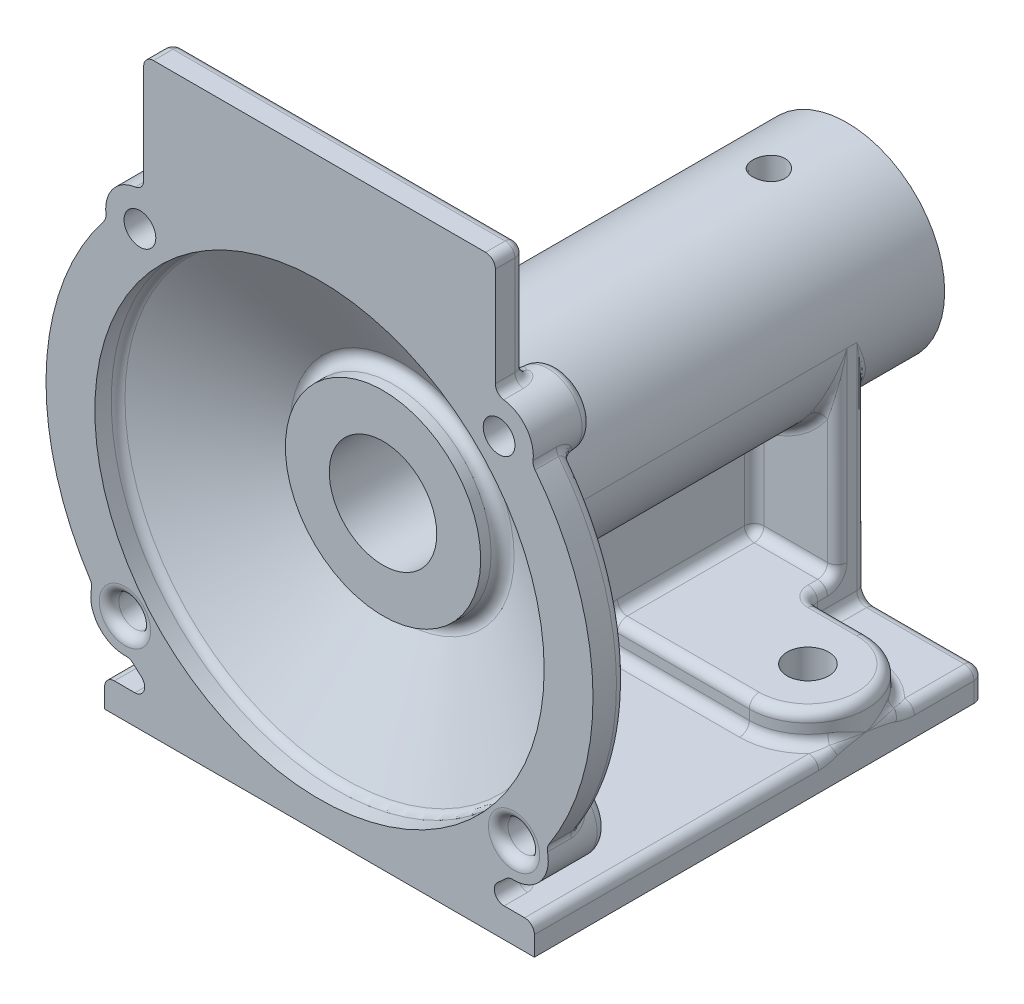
SolidWorks part; units mm, degrees
ref_plane "Front Plane" through (0, 0, 0) normal (0, 0, 1) x (1, 0, 0)
ref_plane "Top Plane" through (0, 0, 0) normal (0, 1, 0) x (1, 0, 0)
ref_plane "Right Plane" through (0, 0, 0) normal (1, 0, 0) x (0, 0, -1)
sketch "Sketch1" plane through (0, 0, 0) normal (1, 0, 0) x (0, 0, -1)
  line L0 (0, -73.025) -> (7.2238, -73.025)
  line L1 (7.2238, -73.025) -> (29.3354, -31.75)
  line L2 (29.3354, -31.75) -> (20.6502, -31.75)
  line L3 (20.6502, -31.75) -> (20.6502, -17.4625)
  line L4 (20.6502, -17.4625) -> (69.85, -17.4625)
  line L5 (69.85, -17.4625) -> (69.85, -20.6375)
  line L6 (69.85, -20.6375) -> (120.65, -20.6375)
  line L7 (120.65, -20.6375) -> (120.65, -17.4625)
  line L8 (120.65, -17.4625) -> (171.45, -17.4625)
  line L9 (171.45, -17.4625) -> (171.45, -31.75)
  line L10 (171.45, -31.75) -> (40.1411, -31.75)
  line L11 (40.1411, -31.75) -> (9.525, -88.9)
  line L12 (9.525, -88.9) -> (0, -88.9)
  line L13 (0, -88.9) -> (0, -73.025)
  line L14 (0, 0) -> (147.7693, 0) construction
  point P17 (57.15, 0)
  dimension "D1" = 9.525
  dimension "D2" = 9.525
  dimension "D3" = 20.6502
  dimension "D4" = 57.15
  dimension "D5" = 63.5
  dimension "D6" = 50.8
  dimension "D7" = 50.8
  dimension "D8" = 34.925
  dimension "D9" = 177.8
  dimension "D10" = 146.05
  dimension "D11" = 171.45
  dimension "D12" = 41.275
revolve "Revolve1" add sketch "Sketch1" angle 360 about L14
sketch "Sketch2" plane through (0, 0, 0) normal (0, 0, 1) x (1, 0, 0)
  line L0 (0, 0) -> (0, 107.95) construction
  line L1 (-57.15, 107.95) -> (57.15, 107.95)
  line L2 (-57.15, 107.95) -> (-57.15, 68.0962)
  line L3 (-57.15, 68.0962) -> (-26.3735, 68.0962)
  line L4 (57.15, 107.95) -> (57.15, 68.0962)
  line L5 (26.3735, 68.0962) -> (57.15, 68.0962)
  circle A0 centre (0, 0) radius 88.9 construction
  circle A1 centre (0, 0) radius 73.025 construction
  arc A2 (26.3735, 68.0962) -> (-26.3735, 68.0962) centre (0, 0) ccw
  dimension "D1" = 114.3
  dimension "D2" = 107.95
extrude "Extrude1" add sketch "Sketch2" against normal blind 9.525
sketch "Sketch3" plane through (0, 0, 0) normal (0, 0, 1) x (1, 0, 0)
  line L0 (0, 0) -> (126.4128, 0) construction
  line L1 (0, 0) -> (89.7747, 89.7747) construction
  line L2 (43.167, 58.9004) -> (50.505, 66.2384)
  line L3 (66.2384, 50.505) -> (58.9004, 43.167)
  circle A0 centre (0, 0) radius 82.55 construction
  circle A1 centre (0, 0) radius 73.025 construction
  arc A2 (50.505, 66.2384) -> (66.2384, 50.505) centre (58.3717, 58.3717) cw
  circle A3 centre (0, 0) radius 73.025 construction
  arc A4 (58.9004, 43.167) -> (43.167, 58.9004) centre (0, 0) ccw
  dimension "D1" = 165.1
  dimension "D3" = 11.1252
  dimension "D2" = 45
extrude "Extrude2" add sketch "Sketch3" against normal blind 19.05
sketch "Sketch4" plane through (0, 0, -19.05) normal (0, 0, -1) x (-1, 0, 0)
  circle A0 centre (-58.3717, 58.3717) radius 5.1562
  dimension "D1" = 10.3124
extrude "Extrude3" cut sketch "Sketch4" against normal through all
pattern_circular "CirPattern1" count 2 every 85 about axis through (0, 0, 0) along (0, 0, 1) of "Extrude3", "Extrude2"
fillet "Fillet21" radius 3.175 1 edges at (62.7876, -47.9255, 0)
mirror "Mirror1" about plane through (0, 0, 0) normal (1, 0, 0) of "CirPattern1", "Extrude2", "Extrude3"
fillet "Fillet22" radius 3.175 1 edges at (-62.7876, -47.9255, 0)
other "DeleteFace1"
ref_plane "Plane1" through (0, -82.55, 0) normal (0, 1, 0) x (-1, 0, 0)
other "SurfaceCut1"
sketch "Sketch5" plane through (0, -82.55, 0) normal (0, 1, 0) x (-1, 0, 0)
  line L0 (-32.9956, 0) -> (32.9956, 0) construction
  line L1 (-69.85, 0) -> (69.85, 0)
  line L2 (-69.85, 0) -> (-69.85, -146.05)
  line L3 (-69.85, -146.05) -> (69.85, -146.05)
  line L4 (69.85, 0) -> (69.85, -146.05)
  line L5 (0, 0) -> (0, -204.9214) construction
  dimension "D1" = 146.05
  dimension "D2" = 139.7
extrude "Extrude4" add sketch "Sketch5" along normal blind 9.525
sketch "Sketch12" plane through (0, 0, -146.05) normal (0, 0, -1) x (-1, 0, 0)
  line L0 (0, -73.025) -> (0, -31.75)
  line L1 (-69.85, -73.025) -> (69.85, -73.025) construction
  circle A0 centre (0, 0) radius 31.75 construction
rib "Rib9" sketch "Sketch12" sketch "Sketch12" thickness 9.525 extrusion direction normal to sketch draft on no parameters "D1"=9.525
sketch "Sketch13" plane through (0, 0, -146.05) normal (0, 0, -1) x (-1, 0, 0)
  line L0 (-69.85, -73.025) -> (-4.7625, -73.025) construction
  line L1 (-31.75, -73.025) -> (31.75, -73.025)
  line L2 (-31.75, -73.025) -> (-31.75, 0)
  line L4 (31.75, -73.025) -> (31.75, 0)
  circle A1 centre (0, 0) radius 31.75 construction
  arc A2 (-31.75, 0) -> (31.75, 0) centre (0, 0) ccw
extrude "Extrude5" add sketch "Sketch13" against normal blind 9.525
sketch "Sketch16" plane through (0, 0, 0) normal (1, 0, 0) x (0, 0, -1)
  line L0 (0, -82.55) -> (146.05, -82.55) construction
  circle A0 centre (63.5, -53.975) radius 12.7
  dimension "D1" = 25.4
  dimension "D2" = 28.575
  dimension "D3" = 63.5
extrude "Extrude8" cut sketch "Sketch16" against normal through all and the other way through all
sketch "Sketch14" plane through (0, -73.025, 0) normal (0, 1, 0) x (1, 0, 0)
  line L0 (4.7625, 88.9) -> (50.8, 88.9)
  line L1 (4.7625, 136.525) -> (4.7625, 17.9464) construction
  line L2 (50.8, 127) -> (31.75, 127)
  line L3 (31.75, 127) -> (31.75, 136.525)
  line L4 (50.7007, 0) -> (69.85, 0) construction
  line L5 (31.75, 136.525) -> (4.7625, 136.525) construction
  line L6 (31.75, 136.525) -> (4.7625, 136.525)
  line L7 (4.7625, 136.525) -> (4.7625, 88.9)
  arc A0 (50.8, 88.9) -> (50.8, 127) centre (50.8, 107.95) ccw
  dimension "D2" = 19.05
  dimension "D1" = 107.95
  dimension "D3" = 50.8
extrude "Extrude6" add sketch "Sketch14" along normal blind 9.525
sketch "Sketch15" plane through (0, -63.5, 0) normal (0, 1, 0) x (1, 0, 0)
  circle A0 centre (50.8, 107.95) radius 6.7437
  arc A1 (50.8, 88.9) -> (50.8, 127) centre (50.8, 107.95) ccw construction
  dimension "D1" = 13.4874
extrude "Extrude7" cut sketch "Sketch15" against normal through all
mirror "Mirror2" about plane through (0, 0, 0) normal (1, 0, 0) of "Extrude7", "Extrude6"
ref_plane "Plane3" through (0, 31.75, -105.7955) normal (0, 1, 0) x (-1, 0, 0)
sketch "Sketch24" plane through (0, 31.75, -105.7955) normal (0, 1, 0) x (-1, 0, 0)
  line L0 (-11.1252, 65.6545) -> (-11.1252, 61.3455)
  line L1 (-31.75, 65.6545) -> (31.75, 65.6545) construction
  line L2 (11.1252, 61.3455) -> (11.1252, 65.6545)
  line L3 (11.1252, 65.6545) -> (-11.1252, 65.6545)
  line L4 (0, 105.7955) -> (0, 20.217) construction
  line L5 (-17.4625, 35.9455) -> (17.4625, 35.9455) construction
  arc A0 (-11.1252, 61.3455) -> (11.1252, 61.3455) centre (0, 61.3455) ccw
  dimension "D1" = 11.1252
  dimension "D2" = 25.4
extrude "Extrude11" add sketch "Sketch24" along normal blind 6.35 and the other way up to next
other "DeleteFace3"
hole_wizard "1/8 NPT Tapped Hole2" positions "3DSketch1" profile "Sketch27" size "1/8" standard "Ansi Inch"
sketch3d "3DSketch1"
  arc A0 (11.1252, 38.1, -44.45) -> (-11.1252, 38.1, -44.45) centre (0, 38.1, -44.45) ccw construction
  point P4 (0, 31.75, -146.05)
  point P6 (0, 38.1, -44.45)
  point P14 (0, 49.2252, -44.45)
  dimension "D1" = 25.4
sketch "Sketch27" plane through (0, 31.75, -146.05) normal (1, 0, 0) x (0, 0, 1)
  line L0 (0, 0) -> (0, 14.2875)
  line L1 (0, 14.2875) -> (4.2164, 14.2875)
  line L2 (-4.9362, 9.525) -> (-5.2214, 0) construction
  line L3 (4.2164, 14.2875) -> (4.2164, 9.525)
  line L4 (4.2164, 9.525) -> (4.9362, 9.525)
  line L5 (4.9362, 9.525) -> (5.2214, 0)
  line L7 (5.2214, 0) -> (0, 0)
  line L8 (0, -6.35) -> (0, 107.95) construction
  line L11 (-4.2164, 9.525) -> (-4.9362, 9.525) construction
  dimension "Thru Tap Drill Dia." = 8.4328
  dimension "Thru Tap Drill Depth" = 14.2875
  dimension "Thread Dia." = 10.4428
  dimension "Thread Angle" = 3.43
  dimension "Thread Depth" = 9.525
fillet "Fillet76" radius 3.175 14 edges at (-31.75, -31.75, -136.525) (31.75, -31.75, -136.525) (-31.75, -63.5, -131.7625) (31.75, -63.5, -131.7625) (-27.7812, -63.5, -88.9) (-41.275, -63.5, -127) (41.275, -63.5, -127) (69.85, -63.5, -107.95) (-69.85, -63.5, -107.95) (-31.75, -68.2625, -127) (-18.2563, -63.5, -136.525) (18.2563, -63.5, -136.525) (31.75, -68.2625, -127) (27.7812, -63.5, -88.9)
fillet "Fillet77" radius 3.175 24 edges at (-31.75, -73.025, -138.1125) (-32.6799, -73.025, -127.9299) (-42.8625, -73.025, -127) (-64.2704, -73.025, -121.4204) (-64.2704, -73.025, -94.4796) (-4.7625, -45.8579, -136.525) (-4.7625, -62.5701, -135.5951) (-4.7625, -63.5, -112.7125) (-4.7625, -64.4299, -89.8299) (4.7625, -45.8579, -136.525) (4.7625, -62.5701, -135.5951) (4.7625, -63.5, -112.7125) (4.7625, -64.4299, -89.8299) (31.75, -73.025, -138.1125) (32.6799, -73.025, -127.9299) (42.8625, -73.025, -127) (64.2704, -73.025, -121.4204) (64.2704, -73.025, -94.4796) (-27.7812, -73.025, -88.9) (-4.7625, -73.025, -53.4232) (-4.7625, -69.85, -88.9) (4.7625, -73.025, -53.4232) (4.7625, -69.85, -88.9) (27.7812, -73.025, -88.9)
fillet "Fillet78" radius 3.175 28 edges at (-50.7007, -73.025, -4.7625) (50.7007, -73.025, -4.7625) (-5.6525, -72.0545, -18.4308) (6.0975, -72.4375, -18.207) (-69.85, -73.025, -48.2512) (-69.85, -73.025, -102.2262) (-69.85, -73.025, -113.6738) (-31.75, -34.925, -146.05) (-32.6799, -72.0951, -146.05) (69.85, -73.025, -48.2512) (69.85, -73.025, -102.2262) (69.85, -73.025, -113.6738) (31.75, -34.925, -146.05) (32.6799, -72.0951, -146.05) (-4.7625, -53.975, -76.2) (4.7625, -53.975, -76.2) (-56.3432, -68.7652, -9.525) (56.3432, -68.7652, -9.525) (-69.85, -73.025, -132.7238) (-52.3875, -73.025, -146.05) (-69.85, -77.7875, -146.05) (69.85, -73.025, -132.7238) (52.3875, -73.025, -146.05) (69.85, -77.7875, -146.05)
fillet "Fillet79" radius 3.175 15 edges at (-30.6752, -8.191, -137.3189) (-31.6957, -1.8554, -40.1411) (-5.5714, -31.2574, -41.0895) (-4.7625, -31.3908, -88.3781) (-5.9268, -31.1919, -135.8072) (31.6957, -1.8554, -40.1411) (5.9455, -31.1884, -40.7249) (4.7625, -31.3908, -88.3781) (5.4424, -31.2801, -135.3134) (30.6752, -8.191, -137.3189) (-30.6752, -8.191, -145.2561) (30.6752, -8.191, -145.2561) (-20.1175, -24.5632, -136.525) (20.1175, -24.5632, -136.525) (0, -31.75, -146.05)
fillet "Fillet80" radius 3.175 11 edges at (11.1252, 38.1, -40.1685) (-11.1252, 38.1, -40.1685) (-11.1252, 30.4035, -40.1504) (-11.1252, 29.7371, -43.246) (11.1252, 29.9951, -40.8268) (11.1252, 29.7371, -43.246) (0, 38.1, -55.5752) (0.9693, 31.7352, -55.5329)
fillet "Fillet81" radius 3.175 3 edges at (0, 88.9, -9.525) (-88.8154, 3.8778, -9.525) (88.8154, 3.8778, -9.525)
fillet "Fillet83" radius 3.175 12 edges at (-51.3725, -57.6296, -19.05) (-65.6748, -40.5848, -19.05) (-61.8877, 46.1543, -19.05) (-46.1543, 61.8877, -19.05) (61.8877, 46.1543, -19.05) (46.1543, 61.8877, -19.05) (51.3725, -57.6296, -19.05) (65.6748, -40.5848, -19.05) (-71.7594, -60.2133, -19.05) (-66.2384, 66.2384, -19.05) (66.2384, 66.2384, -19.05) (71.7594, -60.2133, -19.05)
fillet "Fillet82" radius 3.175 48 edges at (-57.15, 69.4296, -4.7625) (57.15, 69.4296, -4.7625) (-61.6293, -64.0705, -3.812) (-61.4023, -64.035, -8.6861) (-57.773, -62.7531, -11.4549) (-73.799, -49.5673, -3.812) (-73.5874, -48.983, -9.3353) (-69.1981, 55.8107, -3.812) (-69.1429, 55.5876, -8.6861) (-67.5496, 52.0839, -11.4549) (-56.9935, 69.4112, -9.525) (-55.2807, 69.0589, -9.7761) (-53.887, 68.5529, -10.4373) (69.1981, 55.8107, -3.812) (69.0382, 55.2102, -9.3353) (67.5496, 52.0839, -11.4549) (56.9935, 69.4112, -9.525) (56.5106, 69.3401, -9.5345) (53.887, 68.5529, -10.4373) (61.6293, -64.0705, -3.812) (61.0172, -63.9636, -9.3353) (57.773, -62.7531, -11.4549) (73.799, -49.5673, -3.812) (73.7246, -49.3499, -8.6861) (-57.15, 88.6898, -9.525) (57.15, 88.6898, -9.525) (-54.4811, -45.7151, -19.05) (-50.2894, 50.2894, -19.05) (50.2894, 50.2894, -19.05) (54.4811, -45.7151, -19.05) (-48.4686, -52.8351, -18.7398) (-60.7767, -38.5063, -18.6063) (-56.8584, 43.6793, -18.7398) (-43.6568, 57.1894, -18.6063) (57.1894, 43.6568, -18.6063) (43.6793, 56.8584, -18.7398) (48.475, -53.1668, -18.6063) (60.4489, -38.5576, -18.7398)
fillet "Fillet84" radius 3.175 5 edges at (57.15, 107.95, -3.175) (56.2201, 107.95, -8.5951) (-57.15, 107.95, -3.175) (-56.2201, 107.95, -8.5951) (0, 107.95, -9.525)
fillet "Fillet85" radius 3.175 4 edges at (73.025, 0, -7.2238) (31.75, 0, -29.3354) (20.6375, 0, -120.65) (20.6375, 0, -69.85)
